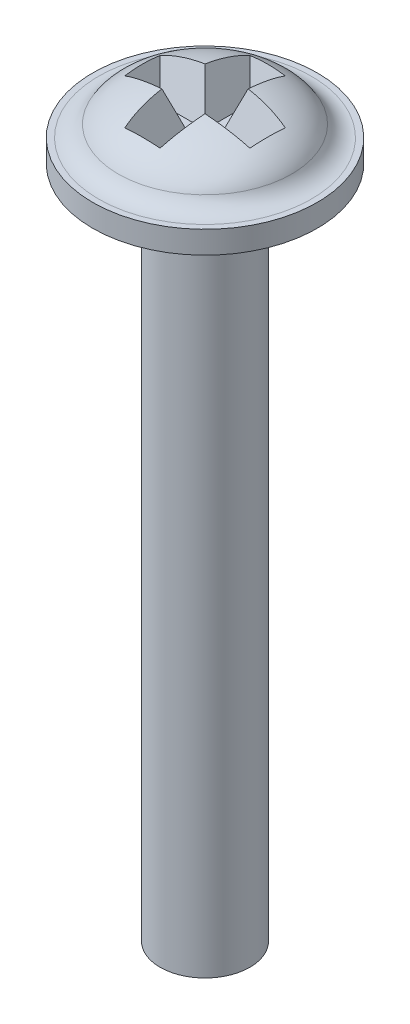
SolidWorks part; units mm, degrees
ref_plane "Front Plane" through (0, 0, 0) normal (0, 0, 1) x (1, 0, 0)
ref_plane "Top Plane" through (0, 0, 0) normal (0, 1, 0) x (1, 0, 0)
ref_plane "Right Plane" through (0, 0, 0) normal (1, 0, 0) x (0, 0, -1)
sketch "Sketch1" plane through (0, 0, 0) normal (0, 1, 0) x (1, 0, 0)
  circle A0 centre (0, 0) radius 2.5
  dimension "D1" = 5
extrude "Boss-Extrude1" add sketch "Sketch1" along normal blind 0.5
sketch "Sketch2" plane through (0, 0, 0) normal (1, 0, 0) x (0, 0, -1)
  line L2 (0, 1.5) -> (0, 0.5)
  line L3 (0, 0.5) -> (-2, 0.5)
  ellipse E0 centre (0, 0.5) end of major axis (-2, 0.5) minor radius 1 (0, 1.5) -> (-2, 0.5) ccw
  point P2 (-2, 0.5)
revolve "Revolve1" add sketch "Sketch2" angle 360 about L2
fillet "Fillet1" radius 0.5 1 edges at (0, 0.5, 2)
ref_plane "Plane1" through (0, 1.5, 0) normal (0, 1, 0) x (1, 0, 0)
sketch "Sketch3" plane through (0, 1.5, 0) normal (0, 1, 0) x (1, 0, 0)
  line L0 (0.5, 1.5) -> (-0.5, -1.5) construction
  line L1 (0.5, 1.5) -> (-0.5, 1.5)
  line L2 (0.5, 1.5) -> (0.5, 0.5)
  line L3 (0.5, -1.5) -> (-0.5, -1.5)
  line L4 (-0.5, 1.5) -> (-0.5, 0.5)
  line L5 (1.5, -0.5) -> (-1.5, 0.5) construction
  line L6 (1.5, 0.5) -> (0.5, 0.5)
  line L7 (1.5, 0.5) -> (1.5, -0.5)
  line L8 (1.5, -0.5) -> (0.5, -0.5)
  line L9 (-1.5, 0.5) -> (-1.5, -0.5)
  line L10 (-0.5, 0.5) -> (-1.5, 0.5)
  line L11 (0.5, -0.5) -> (0.5, -1.5)
  line L12 (-0.5, -0.5) -> (-0.5, -1.5)
  line L13 (-0.5, -0.5) -> (-1.5, -0.5)
  dimension "D1" = 1
  dimension "D2" = 3
extrude "Cut-Extrude1" cut sketch "Sketch3" against normal up to surface (1 mm away) draft 19
sketch "Sketch5" plane through (0, 0, 0) normal (0, -1, 0) x (1, 0, 0)
  circle A0 centre (0, 0) radius 1
  dimension "D1" = 2
extrude "Boss-Extrude2" add sketch "Sketch5" along normal blind 15
